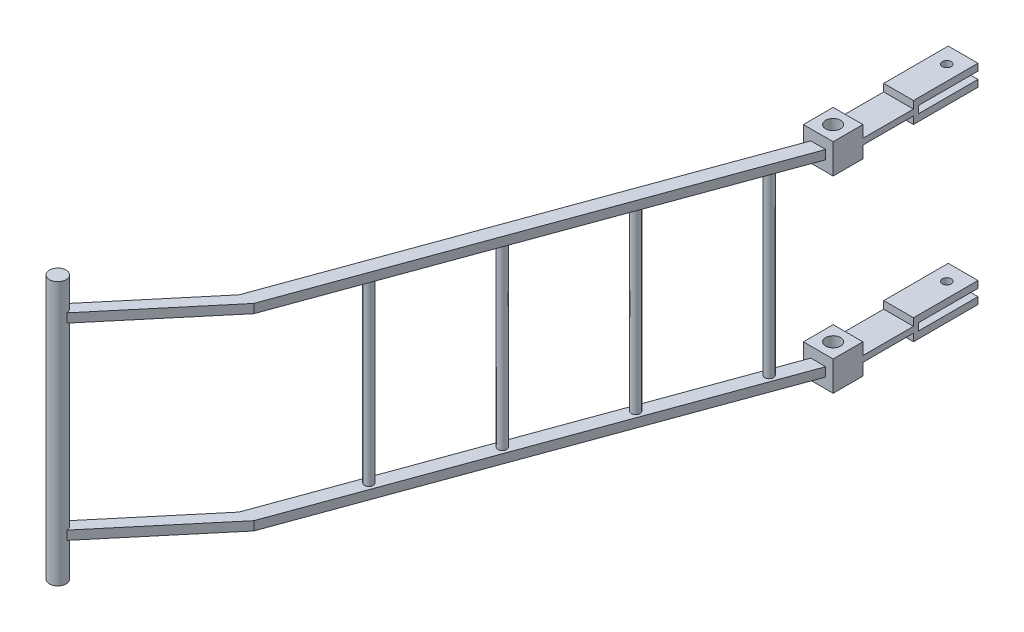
SolidWorks part; units mm, degrees
ref_plane "Front Plane" through (0, 0, 0) normal (0, 0, 1) x (1, 0, 0)
ref_plane "Top Plane" through (0, 0, 0) normal (0, 1, 0) x (1, 0, 0)
ref_plane "Right Plane" through (0, 0, 0) normal (1, 0, 0) x (0, 0, -1)
sketch "Sketch1" plane through (0, 0, 0) normal (0, 0, 1) x (1, 0, 0)
  line L1 (0, 0) -> (10, 0)
  line L2 (0, 0) -> (0, 10)
  line L3 (0, 10) -> (10, 10)
  line L4 (10, 0) -> (10, 10)
  dimension "D1" = 10
  dimension "D2" = 10
extrude "Boss-Extrude1" add sketch "Sketch1" along normal blind 10
sketch "Sketch2" plane through (0, 10, 0) normal (0, 1, 0) x (1, 0, 0)
  circle A0 centre (5, -5) radius 2.5
  dimension "D1" = 5
extrude "Cut-Extrude1" cut sketch "Sketch2" against normal blind 10
sketch "Sketch3" plane through (0, 0, 0) normal (0, 0, -1) x (-1, 0, 0)
  line L0 (-10, 0) -> (-10, 10) construction
  line L1 (-10, 6) -> (0, 6)
  line L2 (-10, 6) -> (-10, 4)
  line L3 (-10, 4) -> (0, 4)
  line L4 (0, 6) -> (0, 4)
  line L5 (0, 10) -> (0, 0) construction
  line L6 (-10, 10) -> (0, 10) construction
  line L7 (0, 0) -> (-10, 0) construction
  dimension "D1" = 4
  dimension "D2" = 4
extrude "Boss-Extrude2" add sketch "Sketch3" along normal blind 17
sketch "Sketch4" plane through (0, 0, -17) normal (0, 0, -1) x (-1, 0, 0)
  line L0 (-10, 0) -> (-10, 4) construction
  line L1 (-10, 1.5) -> (0, 1.5)
  line L2 (-10, 1.5) -> (-10, 8.5)
  line L3 (-10, 8.5) -> (0, 8.5)
  line L4 (0, 1.5) -> (0, 8.5)
  line L5 (0, 10) -> (0, 6) construction
  line L6 (-10, 10) -> (0, 10) construction
  line L7 (0, 0) -> (-10, 0) construction
  dimension "D1" = 1.5
  dimension "D2" = 1.5
extrude "Boss-Extrude3" add sketch "Sketch4" along normal blind 1.7
sketch "Sketch5" plane through (0, 0, -18.7) normal (0, 0, -1) x (-1, 0, 0)
  line L0 (0, 1.5) -> (0, 8.5) construction
  line L1 (-10, 1.5) -> (0, 1.5)
  line L2 (-10, 1.5) -> (-10, 3.8)
  line L3 (-10, 3.8) -> (0, 3.8)
  line L4 (0, 1.5) -> (0, 3.8)
  line L6 (-10, 8.5) -> (0, 8.5)
  line L7 (-10, 8.5) -> (-10, 6.2)
  line L8 (-10, 6.2) -> (0, 6.2)
  line L9 (0, 8.5) -> (0, 6.2)
  dimension "D1" = 2.3
  dimension "D2" = 2.3
extrude "Boss-Extrude4" add sketch "Sketch5" along normal blind 20
sketch "Sketch6" plane through (0, 8.5, 0) normal (0, 1, 0) x (1, 0, 0)
  line L0 (0, 38.7) -> (0, 17) construction
  line L2 (0, 38.7) -> (10, 38.7) construction
  circle A0 centre (5, 33.2) radius 1.5
  dimension "D1" = 3
  dimension "D2" = 5
  dimension "D3" = 5.5
extrude "Cut-Extrude2" cut sketch "Sketch6" against normal blind 20
ref_plane "Plane1" through (0, 5, 0) normal (0, 1, 0) x (-1, 0, 0)
sketch "Sketch7" plane through (0, 5, 0) normal (0, 1, 0) x (-1, 0, 0)
  line L0 (-5, 10) -> (46.303, 150.9539)
  line L1 (0, 10) -> (-10, 10) construction
  line L2 (0, 10) -> (0, 0) construction
  dimension "D1" = 160
  dimension "D2" = 150
ref_plane "Plane2" through (-46.303, 5, 150.9539) normal (-0.342, 0, 0.9397) x (0.9397, 0, 0.342)
ref_plane "Plane6" through (0, 0, 10) normal (0, 0, 1) x (1, 0, 0)
sketch "Sketch10" plane through (0, 0, 10) normal (0, 0, 1) x (1, 0, 0)
  line L1 (7.5, 6.5) -> (2.5, 6.5)
  line L2 (7.5, 6.5) -> (7.5, 3.5)
  line L3 (7.5, 3.5) -> (2.5, 3.5)
  line L4 (2.5, 6.5) -> (2.5, 3.5)
  dimension "D1" = 1.5
  dimension "D2" = 1.5
  dimension "D3" = 2.5
  dimension "D4" = 2.5
sweep "Sweep1" add profiles "Sketch10" path "Sketch7"
sketch "Sketch11" plane through (0, 5, 0) normal (0, 1, 0) x (-1, 0, 0)
  line L0 (46.303, 150.9539) -> (75.2285, 185.4259)
  line L1 (43.803, 150.9539) -> (48.803, 150.9539) construction
  line L2 (48.803, 150.9539) -> (-2.5, 10) construction
  dimension "D1" = 45
  dimension "D2" = 160
ref_plane "Plane7" through (0, 0, 150.9539) normal (0, 0, 1) x (1, 0, 0)
sketch "Sketch12" plane through (0, 0, 150.9539) normal (0, 0, 1) x (1, 0, 0)
  line L0 (-48.803, 3.5) -> (-43.803, 3.5) construction
  line L1 (-43.803, 6.5) -> (-48.803, 6.5)
  line L2 (-43.803, 6.5) -> (-43.803, 3.5)
  line L3 (-43.803, 3.5) -> (-48.803, 3.5)
  line L4 (-48.803, 6.5) -> (-48.803, 3.5)
sweep "Sweep2" add profiles "Sketch12" path "Sketch11"
ref_plane "Plane8" through (0, 0, 185.4259) normal (0, 0, 1) x (1, 0, 0)
sketch "Sketch13" plane through (0, 0, 185.4259) normal (0, 0, 1) x (1, 0, 0)
  line L0 (-75.2285, 5) -> (-75.2285, 65.6)
  line L1 (-75.2285, 65.6) -> (-75.2285, 79.6)
  line L2 (-75.2285, 5) -> (-75.2285, -9)
  dimension "D1" = 60.6
ref_plane "Plane9" through (-75.2285, -9, 185.4259) normal (0, -1, 0) x (1, 0, 0)
sketch "Sketch14" plane through (-75.2285, -9, 185.4259) normal (0, -1, 0) x (1, 0, 0)
  circle A0 centre (0, 0) radius 2.8
sweep "Sweep3" add profiles "Sketch14" path "Sketch13"
ref_plane "Plane10" through (0, 36.625, 0) normal (0, 1, 0) x (-1, 0, 0)
mirror "Mirror2" about plane through (0, 36.625, 0) normal (0, 1, 0) of "Sweep2", "Sweep1"
mirror "Mirror3" about plane through (0, 36.625, 0) normal (0, 1, 0) of "Sweep1"
mirror "Mirror4" about plane through (0, 36.625, 0) normal (0, 1, 0) of "Cut-Extrude1", "Boss-Extrude1", "Mirror3"
mirror "Mirror5" about plane through (0, 36.625, 0) normal (0, 1, 0) of "Cut-Extrude2", "Boss-Extrude4", "Boss-Extrude3", "Boss-Extrude2"
sketch "Sketch15" plane through (0, 66.75, 0) normal (0, -1, 0) x (1, 0, 0)
  circle A0 centre (0.4872, 21.9885) radius 1.45
ref_plane "Plane12" through (7.4972, 0, 2.7287) normal (0.9397, 0, 0.342) x (0.342, 0, -0.9397)
sketch "Sketch16" plane through (7.4972, 0, 2.7287) normal (0.9397, 0, 0.342) x (0.342, 0, -0.9397)
  line L0 (-20.4958, 66.75) -> (-20.4958, 5.75)
sweep "Sweep4" add profiles "Sketch15" path "Sketch16"
pattern_linear "LPattern1" count 4 spacing 35 along (-0.342, 0, 0.9397) of "Sweep4"
